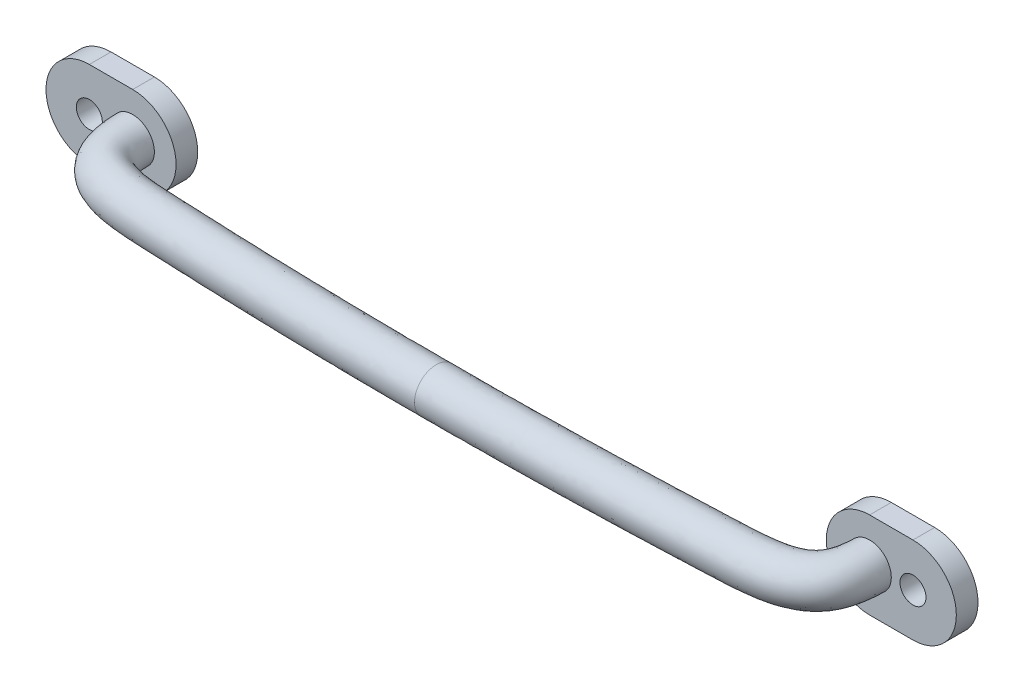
SolidWorks part; units mm, degrees
ref_plane "Front" through (0, 0, 0) normal (0, 0, 1) x (1, 0, 0)
ref_plane "Top" through (0, 0, 0) normal (0, 1, 0) x (1, 0, 0)
ref_plane "Right" through (0, 0, 0) normal (1, 0, 0) x (0, 0, -1)
sketch "Sketch1" plane through (0, 0, 0) normal (0, 0, 1) x (1, 0, 0)
  line L0 (0, 6.35) -> (0, -6.35) construction
  line L1 (53.975, 6.35) -> (60.325, 6.35)
  line L2 (53.975, -6.35) -> (60.325, -6.35)
  line L3 (-53.975, -6.35) -> (-60.325, -6.35)
  line L4 (-53.975, 6.35) -> (-60.325, 6.35)
  line L5 (0, 0) -> (60.325, 0) construction
  circle A0 centre (-60.325, 0) radius 1.905
  arc A1 (60.325, -6.35) -> (60.325, 6.35) centre (60.325, 0) ccw
  arc A2 (-53.975, 6.35) -> (-53.975, -6.35) centre (-53.975, 0) cw
  arc A3 (53.975, 6.35) -> (53.975, -6.35) centre (53.975, 0) ccw
  circle A4 centre (60.325, 0) radius 1.905
  arc A5 (-60.325, -6.35) -> (-60.325, 6.35) centre (-60.325, 0) cw
  dimension "D4" = 3.81
  dimension "D2" = 6.35
  dimension "D1" = 60.325
  dimension "D3" = 6.35
extrude "Extrude1" add sketch "Sketch1" along normal blind 3.175
sketch "Sketch3" plane through (0, 0, 0) normal (0, 1, 0) x (1, 0, 0)
  line L0 (0, 0) -> (0, -12.7) construction
  line L2 (60.325, -3.175) -> (53.975, -3.175) construction
  spline S0 degree 3 poles (-53.975, -3.175) (-53.975, -4.223) (-53.3966, -11.122) (-29.5075, -12.3519) (-12.8441, -12.7) (0, -12.7) knots 0 0 0 0 0.084063 0.290452 1 1 1 1
  spline S1 degree 3 poles (53.975, -3.175) (53.975, -4.223) (53.3966, -11.122) (29.5075, -12.3519) (12.8441, -12.7) (0, -12.7) knots 0 0 0 0 0.084063 0.290452 1 1 1 1
  dimension "D1" = 12.7
sketch "Sketch4" plane through (0, 0, 3.175) normal (0, 0, 1) x (1, 0, 0)
  circle A0 centre (53.975, 0) radius 3.175
  dimension "D1" = 6.35
sweep "Sweep2" add profiles "Sketch4" path "Sketch3"
